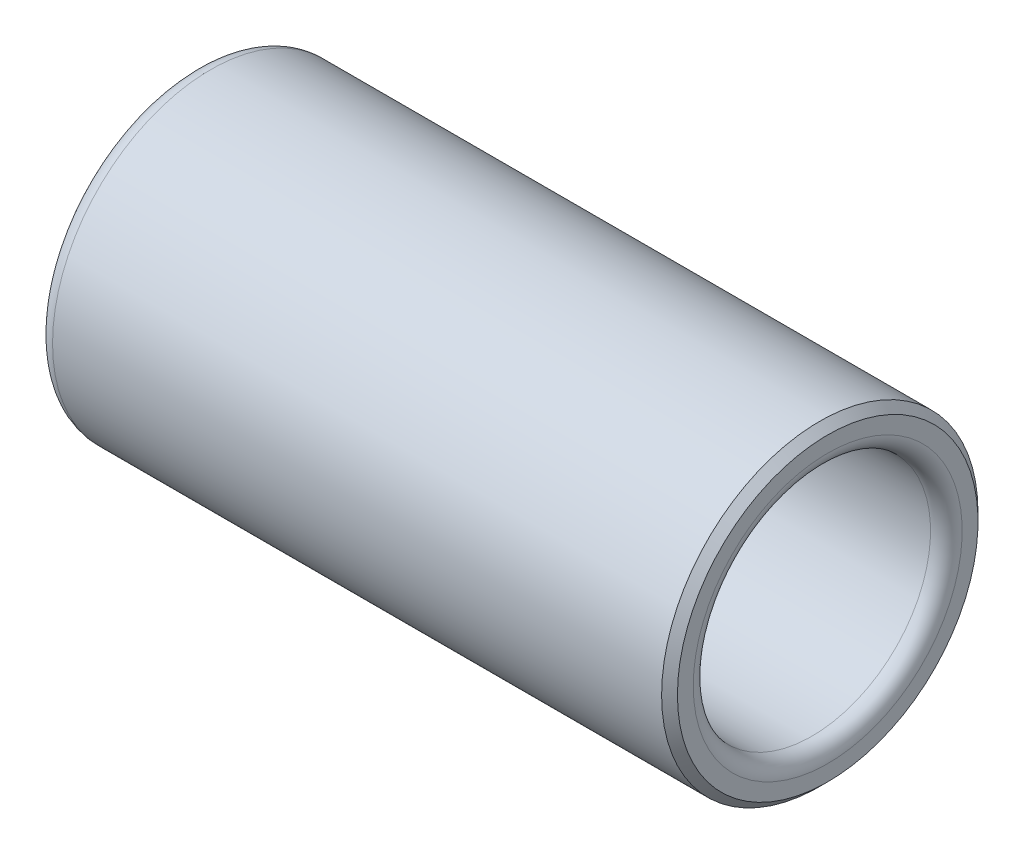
SolidWorks part; units mm, degrees
ref_plane "Plan de face" through (0, 0, 0) normal (0, 0, 1) x (1, 0, 0)
ref_plane "Plan de dessus" through (0, 0, 0) normal (0, 1, 0) x (1, 0, 0)
ref_plane "Plan de droite" through (0, 0, 0) normal (1, 0, 0) x (0, 0, -1)
sketch "Esquisse1" plane through (0, 0, 0) normal (0, 0, 1) x (1, 0, 0)
  line L0 (-64.6395, 0) -> (79.9877, 0) construction
  line L1 (0, 6) -> (0, 10)
  line L2 (7.5981, 7.5) -> (5, 6)
  line L3 (5, 6) -> (0, 6)
  line L6 (0, 10) -> (40, 10)
  line L7 (40, 10) -> (40, 7.5)
  line L8 (40, 7.5) -> (7.5981, 7.5)
  dimension "D1" = 15
  dimension "D2" = 20
  dimension "D3" = 40
  dimension "D4" = 12
  dimension "D5" = 30
  dimension "D6" = 5
revolve "Révolution1" add sketch "Esquisse1" angle 360 about L0
chamfer "Chanfrein1" distance 0.5 angle 45 1 edges at (40, 0, 10)
fillet "Congé1" radius 1 2 edges at (40, 0, 7.5) (0, 0, 10)
